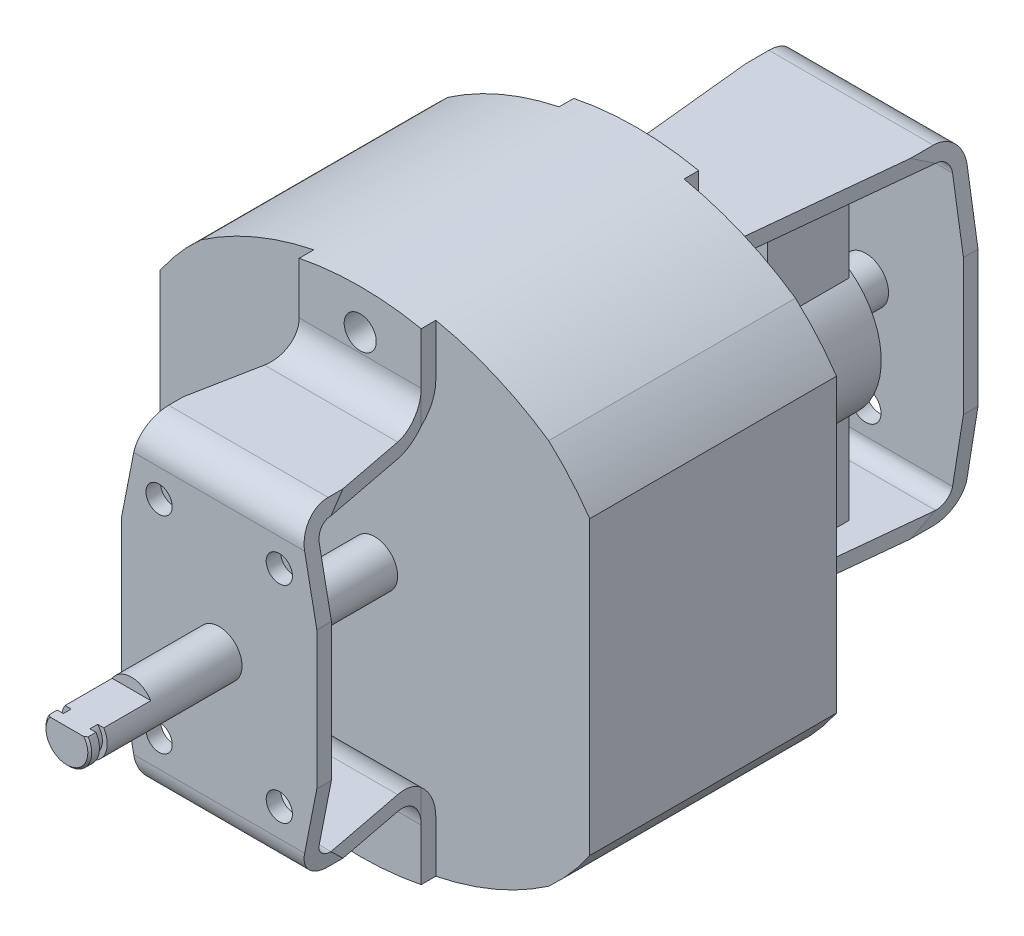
SolidWorks part; units mm, degrees
ref_plane "Plane1" through (0, 0, 0) normal (0, 0, 1) x (1, 0, 0)
ref_plane "Plane2" through (0, 0, 0) normal (0, 1, 0) x (1, 0, 0)
ref_plane "Plane3" through (0, 0, 0) normal (1, 0, 0) x (0, 0, -1)
sketch "motor core shape" plane through (0, 0, 0) normal (0, 0, 1) x (1, 0, 0)
  line L0 (-5.8998, 26.05) -> (5.8998, 26.05)
  line L1 (-22.1, 15) -> (-22.1, -15)
  line L2 (5.8998, -26.05) -> (-5.8998, -26.05)
  line L3 (22.1, -15) -> (22.1, 15)
  arc A0 (-5.8998, 26.05) -> (-22.1, 15) centre (0, 0) ccw
  arc A1 (-22.1, -15) -> (-5.8998, -26.05) centre (0, 0) ccw
  arc A2 (5.8998, -26.05) -> (22.1, -15) centre (0, 0) ccw
  arc A3 (22.1, 15) -> (5.8998, 26.05) centre (0, 0) ccw
  dimension "D1" = 44.2
  dimension "D2" = 52.1
  dimension "D3" = 30
  dimension "D4" = 11.7996
extrude "motor core" add sketch "motor core shape" along normal blind 25.38
sketch "Sketch5" plane through (0, 0, 25.38) normal (0, 0, 1) x (1, 0, 0)
  line L0 (0, 30.7658) -> (0, -31.4186) construction
  line L1 (-27.6647, 0) -> (27.0118, 0) construction
  line L2 (-5.8998, 26.05) -> (5.8998, 26.05) construction
  line L5 (8.2, 16.45) -> (10.04, 7.075)
  line L6 (-8.2, 16.45) -> (-10.04, 7.075)
  line L7 (10.04, 7.075) -> (10.04, -7.075)
  line L8 (-10.04, 7.075) -> (-10.04, -7.075)
  line L9 (-8.2, -16.45) -> (-10.04, -7.075)
  line L10 (8.2, -16.45) -> (10.04, -7.075)
  line L15 (-8.2, 16.45) -> (8.2, 16.45)
  line L16 (-8.2, -16.45) -> (8.2, -16.45)
  point P9 (0, 25.95)
  point P16 (-10.04, 0)
  point P17 (10.04, 0)
  point P21 (0, -25.95)
  dimension "D1" = 16.4
  dimension "D2" = 9.6
  dimension "D4" = 20.08
  dimension "D5" = 14.15
extrude "gear end plate" add sketch "Sketch5" along normal blind 16
fillet "gear end plate fillet" radius 3 2 edges at (0, -16.45, 41.38) (-8.2, 16.45, 33.38)
sketch "Sketch7" plane through (-10.04, 0, 0) normal (-1, 0, 0) x (0, 0, 1)
  line L0 (25.38, 15) -> (25.38, -15) construction
  line L1 (25.38, 14.95) -> (25.38, -14.95)
  line L5 (38.38, -14.95) -> (25.38, -14.95)
  line L6 (39.88, -13.45) -> (39.88, -7.075)
  line L7 (39.88, 7.075) -> (39.88, -7.075)
  line L8 (39.88, 13.45) -> (39.88, 7.075)
  line L9 (38.38, 14.95) -> (25.38, 14.95)
  line L10 (38.38, -14.95) -> (25.38, -14.95)
  line L11 (39.88, -13.45) -> (39.88, -7.075)
  line L12 (39.88, 7.075) -> (39.88, -7.075)
  line L13 (39.88, 13.45) -> (39.88, 7.075)
  line L14 (38.38, 14.95) -> (25.38, 14.95)
  arc A2 (38.38, -14.95) -> (39.88, -13.45) centre (38.38, -13.45) ccw
  arc A3 (39.88, 13.45) -> (38.38, 14.95) centre (38.38, 13.45) ccw
  arc A4 (38.38, -14.95) -> (39.88, -13.45) centre (38.38, -13.45) ccw
  arc A5 (39.88, 13.45) -> (38.38, 14.95) centre (38.38, 13.45) ccw
  dimension "D1" = 1.5
extrude "gear end plate cut" cut sketch "Sketch7" against normal through all
sketch "Sketch8" plane through (0, 0, 25.38) normal (0, 0, 1) x (1, 0, 0)
  line L0 (0, 16.45) -> (0, -16.45) construction
  line L1 (6.275, 25.95) -> (6.275, 16.45)
  line L2 (-30.1129, 0) -> (30.1129, 0) construction
  line L3 (-6.275, -25.95) -> (-6.275, -16.45)
  line L4 (5.8998, -25.95) -> (-5.8998, -25.95)
  line L5 (6.275, -25.95) -> (-6.275, -25.95)
  line L6 (-6.275, 25.95) -> (-6.275, 16.45)
  line L7 (6.275, -25.95) -> (6.275, -16.45)
  line L8 (8.2, -16.45) -> (-8.2, -16.45) construction
  line L9 (6.275, 16.45) -> (-6.275, 16.45)
  line L10 (6.275, -16.45) -> (-6.275, -16.45)
  line L12 (6.275, 25.95) -> (-6.275, 25.95)
  point P19 (0, 0)
  dimension "D2" = 12.55
  dimension "D1" = 0.1
extrude "gear end plate tabs" add sketch "Sketch8" along normal blind 1.5
sketch "Sketch9" plane through (0, -16.45, 0) normal (0, -1, 0) x (1, 0, 0)
  line L0 (-8.2, 25.38) -> (-6.275, 25.38) construction
  line L1 (6.275, 25.38) -> (8.2, 25.38) construction
  line L2 (-8.4944, 25.38) -> (-6.275, 25.38)
  line L3 (6.275, 25.38) -> (8.4944, 25.38)
  line L6 (-8.4944, 38.38) -> (-8.4944, 25.38) construction
  line L7 (8.4944, 38.38) -> (6.275, 26.88)
  line L8 (-6.275, 26.88) -> (-6.275, 25.38) construction
  line L9 (6.275, 26.88) -> (6.275, 25.38) construction
  line L10 (-6.275, 26.88) -> (-6.275, 25.38)
  line L11 (6.275, 26.88) -> (6.275, 25.38)
  line L12 (-6.275, 26.88) -> (-8.4944, 38.38)
  line L13 (-8.4944, 38.38) -> (-8.4944, 25.38)
  line L14 (8.4944, 38.38) -> (8.4944, 25.38) construction
  line L15 (8.4944, 38.38) -> (8.4944, 25.38)
extrude "gear end side cut" cut sketch "Sketch9" against normal through all
fillet "gear end tab fillet" radius 3 2 edges at (0, -16.45, 26.88) (0, 16.45, 26.88)
sketch "Sketch10" plane through (-6.275, 0, 0) normal (-1, 0, 0) x (0, 0, 1)
  line L0 (25.38, 19.45) -> (25.38, 14.95)
  line L2 (29.88, 14.95) -> (25.38, 14.95)
  line L3 (29.88, -14.95) -> (25.38, -14.95)
  line L4 (25.38, -19.45) -> (25.38, -14.95)
  arc A3 (25.38, 19.45) -> (29.88, 14.95) centre (29.88, 19.45) ccw
  arc A4 (25.38, 19.45) -> (29.88, 14.95) centre (29.88, 19.45) ccw
  arc A5 (29.88, -14.95) -> (25.38, -19.45) centre (29.88, -19.45) ccw
  arc A6 (29.88, -14.95) -> (25.38, -19.45) centre (29.88, -19.45) ccw
  dimension "D1" = 1.5
  dimension "D2" = 1.5
extrude "gear end kludge fillet" cut sketch "Sketch10" against normal through all and the other way through all
sketch "Sketch11" plane through (0, 0, 41.38) normal (0, 0, 1) x (1, 0, 0)
  line L0 (0, -20.7281) -> (0, 30.0313) construction
  line L1 (-15.0973, 0) -> (30.1129, 0) construction
  circle A0 centre (6.1825, 10.5986) radius 1.35
  circle A1 centre (-6.1825, 10.5986) radius 1.35
  circle A2 centre (-6.1825, -10.5986) radius 1.35
  circle A3 centre (6.1825, -10.5986) radius 1.35
  dimension "D1" = 27.24
  dimension "D2" = 2.7
extrude "gear caddy screw holes" cut sketch "Sketch11" against normal up to next
sketch "Sketch13" plane through (0, 0, 0) normal (0, 0, -1) x (-1, 0, 0)
  line L0 (0, 16.95) -> (0, -16.95) construction
  line L1 (-10.05, 0) -> (10.05, 0) construction
  line L2 (-8.45, 16.95) -> (8.45, 16.95)
  line L3 (8.45, 16.95) -> (10.05, 7)
  line L4 (-10.05, 7) -> (-10.05, -7)
  line L5 (10.05, 7) -> (10.05, -7)
  line L6 (-8.45, 16.95) -> (-10.05, 7)
  line L7 (-8.45, -16.95) -> (-10.05, -7)
  line L8 (8.45, -16.95) -> (10.05, -7)
  line L9 (-8.45, -16.95) -> (8.45, -16.95)
  point P5 (-10.05, 0)
  point P10 (0, 16.45)
  point P12 (0, 16.95)
  point P15 (-10.04, 0)
  point P16 (10.04, 0)
  point P17 (10.05, 0)
  point P18 (0, -16.45)
  point P19 (0, -16.95)
  dimension "D1" = 14
  dimension "D2" = 33.9
  dimension "D3" = 16.9
  dimension "D4" = 20.1
extrude "rotor end plate" add sketch "Sketch13" along normal blind 26.6
fillet "rotor end plate fillet" radius 3 2 edges at (0, 16.95, -26.6) (8.45, -16.95, -13.3)
sketch "Sketch14" plane through (10.05, 0, 0) normal (1, 0, 0) x (0, 0, -1)
  line L0 (0, -15) -> (0, 15) construction
  line L1 (0, -15.45) -> (0, 15.45)
  line L5 (23.6, -15.45) -> (0, -15.45)
  line L6 (25.1, -13.95) -> (25.1, -7)
  line L7 (25.1, 7) -> (25.1, -7)
  line L8 (25.1, 13.95) -> (25.1, 7)
  line L9 (23.6, 15.45) -> (0, 15.45)
  line L10 (23.6, -15.45) -> (0, -15.45)
  line L11 (25.1, -13.95) -> (25.1, -7)
  line L12 (25.1, 7) -> (25.1, -7)
  line L13 (25.1, 13.95) -> (25.1, 7)
  line L14 (23.6, 15.45) -> (0, 15.45)
  arc A2 (23.6, -15.45) -> (25.1, -13.95) centre (23.6, -13.95) ccw
  arc A3 (25.1, 13.95) -> (23.6, 15.45) centre (23.6, 13.95) ccw
  arc A4 (23.6, -15.45) -> (25.1, -13.95) centre (23.6, -13.95) ccw
  arc A5 (25.1, 13.95) -> (23.6, 15.45) centre (23.6, 13.95) ccw
  dimension "D1" = 1.5
extrude "rotor end plate cut" cut sketch "Sketch14" against normal through all and the other way through all
sketch "Sketch15" plane through (0, 0, 0) normal (0, 0, -1) x (-1, 0, 0)
  line L0 (-6.425, 25.95) -> (6.425, 25.95)
  line L1 (-6.425, 25.95) -> (-6.425, 16.95)
  line L2 (-8.45, 16.95) -> (8.45, 16.95) construction
  line L3 (-6.425, 16.95) -> (6.425, 16.95)
  line L4 (0, 30.1945) -> (0, -31.9899) construction
  line L5 (-30.3577, 0) -> (31.9899, 0) construction
  line L6 (6.425, 25.95) -> (6.425, 16.95)
  line L7 (6.425, -25.95) -> (6.425, -16.95)
  line L8 (-6.425, -16.95) -> (6.425, -16.95)
  line L9 (-6.425, -25.95) -> (-6.425, -16.95)
  line L10 (-6.425, -25.95) -> (6.425, -25.95)
  line L11 (5.8998, 26.05) -> (-5.8998, 26.05) construction
  point P13 (0, 16.95)
  point P14 (0, 25.95)
  point P18 (0, -25.95)
  point P19 (0, -16.95)
  dimension "D1" = 12.85
  dimension "D2" = 0.1
extrude "rotor end plate tabs" add sketch "Sketch15" along normal blind 1.5
sketch "Sketch16" plane through (0, -16.95, 0) normal (0, -1, 0) x (1, 0, 0)
  line L2 (-8.6912, -23.6) -> (-8.6912, 0) construction
  line L3 (-6.425, -1.5) -> (-6.425, 0) construction
  line L4 (6.425, -1.5) -> (6.425, 0) construction
  line L5 (8.6912, -23.6) -> (8.6912, 0) construction
  line L6 (-8.6912, -23.6) -> (-8.6912, 0)
  line L7 (-6.425, -1.5) -> (-6.425, 0)
  line L8 (6.425, -1.5) -> (6.425, 0)
  line L9 (8.6912, -23.6) -> (8.6912, 0)
  line L10 (8.6912, 0) -> (6.425, 0)
  line L11 (6.425, -1.5) -> (8.6912, -23.6)
  line L12 (-6.425, 0) -> (-8.6912, 0)
  line L13 (-6.425, -1.5) -> (-8.6912, -23.6)
extrude "rotor end side ct" cut sketch "Sketch16" against normal through all and the other way through all
fillet "rotor end tab fillet" radius 3 2 edges at (0, -16.95, -1.5) (0, 16.95, -1.5)
sketch "Sketch17" plane through (-6.425, 0, 0) normal (-1, 0, 0) x (0, 0, 1)
  line L0 (0, 19.95) -> (0, 15.45)
  line L2 (-4.5, 15.45) -> (0, 15.45)
  line L3 (0, -19.95) -> (0, -15.45)
  line L5 (-4.5, -15.45) -> (0, -15.45)
  arc A1 (-4.5, 15.45) -> (0, 19.95) centre (-4.5, 19.95) ccw
  arc A2 (-4.5, 15.45) -> (0, 19.95) centre (-4.5, 19.95) ccw
  arc A3 (0, -19.95) -> (-4.5, -15.45) centre (-4.5, -19.95) ccw
  arc A4 (0, -19.95) -> (-4.5, -15.45) centre (-4.5, -19.95) ccw
  dimension "D1" = 1.5
  dimension "D2" = 1.5
extrude "rotor end kludge fillet" cut sketch "Sketch17" against normal through all and the other way through all
sketch "Sketch12" plane through (0, 0, 0) normal (0, 0, -1) x (-1, 0, 0)
  line L0 (-28.8072, 0) -> (27.0118, 0) construction
  line L1 (5.8998, 26.05) -> (-5.8998, 26.05) construction
  circle A0 centre (0, 21.3) radius 1.65
  circle A1 centre (0, -21.3) radius 1.65
  dimension "D1" = 3.3
  dimension "D2" = 4.75
extrude "motor long screw holes" cut sketch "Sketch12" against normal through all and the other way through all
sketch "Sketch1" plane through (0, 0, 25.38) normal (0, 0, 1) x (1, 0, 0)
  circle A0 centre (0, 0) radius 2.35
  dimension "D1" = 4.7
extrude "motor shaft" add sketch "Sketch1" along normal blind 31.66 and the other way offset from surface (54.08 mm away) 28.7
sketch "Sketch3" plane through (0, 0, 57.04) normal (0, 0, 1) x (1, 0, 0)
  circle A0 centre (0, 0) radius 2.35 construction
  circle A1 centre (0, 0) radius 1.85
  circle A2 centre (0, 0) radius 1.85
  circle A3 centre (0, 0) radius 2.35
  dimension "D1" = 0.5
extrude "groove cut" cut sketch "Sketch3" against normal blind 1.8
sketch "Sketch4" plane through (0, 0, 57.04) normal (0, 0, 1) x (1, 0, 0)
  circle A0 centre (0, 0) radius 2.35 construction
  circle A1 centre (0, 0) radius 2.35
extrude "groove fill" add sketch "Sketch4" against normal offset from surface (1 mm away) 0.8
chamfer "shaft chamfer" distance 0.2 angle 45 1 edges at (2.35, 0, 57.04)
sketch "Sketch2" plane through (0, 0, 57.04) normal (0, 0, 1) x (1, 0, 0)
  line L0 (-1.99, 1.25) -> (1.99, 1.25)
  circle A0 centre (0, 0) radius 2.35 construction
  arc A1 (1.99, 1.25) -> (-1.99, 1.25) centre (0, 0) ccw
  dimension "D1" = 3.6
extrude "motor gear flat" cut sketch "Sketch2" against normal blind 6.64
sketch "Sketch18" plane through (0, 0, -26.6) normal (0, 0, -1) x (-1, 0, 0)
  line L0 (-33.3772, 0) -> (32.8875, 0) construction
  circle A0 centre (0, 11.12) radius 1.58
  circle A1 centre (0, -11.12) radius 1.58
  dimension "D1" = 3.16
  dimension "D2" = 25.4
extrude "rotor end plate holes" cut sketch "Sketch18" against normal up to next
ref_plane "Plane4" through (0, 0, -18.7) normal (0, 0, -1) x (-1, 0, 0)
sketch "Sketch20" plane through (0, 0, -18.7) normal (0, 0, -1) x (-1, 0, 0)
  circle A1 centre (0, 0) radius 2.35 construction
  circle A2 centre (0, 0) radius 2.35
  circle A3 centre (0, 0) radius 8
  dimension "D1" = 16
extrude "motor rotor" add sketch "Sketch20" against normal blind 12
sketch "Sketch21" plane through (0, 16.95, 0) normal (0, 1, 0) x (-1, 0, 0)
  line L0 (0, 0) -> (0, -32.7148) construction
  line L1 (0, 0) -> (0, -6.7) construction
  line L2 (5.1372, -18.2466) -> (-5.1372, -18.2466)
  line L3 (-5.1372, -18.2466) -> (-5.1372, -9.8593)
  line L4 (5.1372, -18.2466) -> (5.1372, -9.8593)
  line L5 (-5.1372, -9.8593) -> (5.1372, -9.8593)
  point P8 (0, -18.2466)
  point P11 (0, -9.8593)
extrude "motor stator,brushes" add sketch "Sketch21" along normal up to surface (33.9 mm away)
sketch "Sketch22" plane through (0, 0, 26.88) normal (0, 0, 1) x (1, 0, 0)
  line L0 (0, 0) -> (15.3278, 0) construction
  line L1 (28.8072, 0) -> (-27.0118, 0) construction
  line L3 (-5.8998, 26.05) -> (6.425, 25.9255)
  line L4 (-5.8998, -26.05) -> (6.425, -25.9255)
  arc A0 (31.4115, -2.6863) -> (-31.3668, -2.3101) centre (0, -6.2245) ccw construction
  arc A1 (17.8771, -19.8448) -> (6.425, -25.9255) centre (0, 0) cw
  arc A2 (-5.8998, -26.05) -> (-17.8771, -19.8448) centre (0, 0) cw
  arc A3 (17.8771, 19.8448) -> (-17.8771, 19.8448) centre (0, -6.2245) ccw
  arc A4 (-5.8998, 26.05) -> (-6.3251, 25.95) centre (0, 0) ccw construction
  arc A5 (-5.8998, 26.05) -> (-17.8771, 19.8448) centre (0, 0) ccw
  arc A6 (22.1, 15) -> (6.425, 25.9255) centre (0, 0) ccw construction
  arc A7 (17.8771, 19.8448) -> (6.425, 25.9255) centre (0, 0) ccw
  arc A8 (17.8771, -19.8448) -> (-17.8771, -19.8448) centre (0, 6.2245) cw
extrude "Cut-Extrude1" cut sketch "Sketch22" against normal through all
